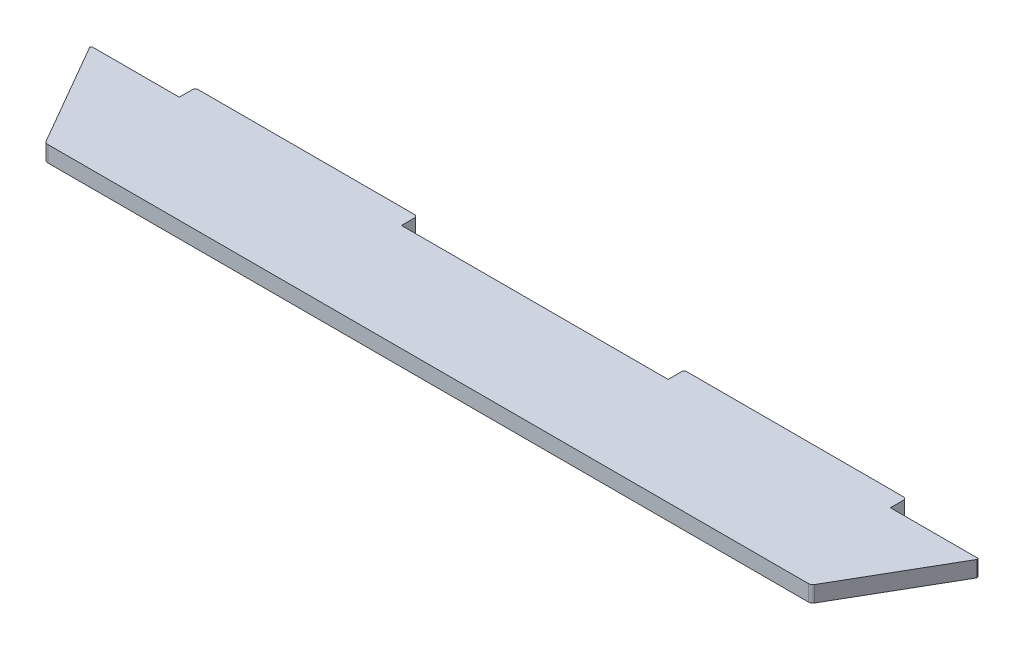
SolidWorks part; units mm, degrees
ref_plane "Alzado" through (0, 0, 0) normal (0, 0, 1) x (1, 0, 0)
ref_plane "Planta" through (0, 0, 0) normal (0, 1, 0) x (1, 0, 0)
ref_plane "Vista lateral" through (0, 0, 0) normal (1, 0, 0) x (0, 0, -1)
sketch "Croquis1" plane through (0, 0, 0) normal (0, 1, 0) x (1, 0, 0)
  line L0 (0, 0) -> (0, 433.0127) construction
  line L1 (250, 433.0127) -> (-250, 433.0127)
  line L2 (-250, 433.0127) -> (-500, 0)
  line L3 (-500, 0) -> (-250, -433.0127)
  line L4 (-250, -433.0127) -> (250, -433.0127)
  line L5 (250, -433.0127) -> (500, 0)
  line L6 (500, 0) -> (250, 433.0127)
  circle A0 centre (0, 0) radius 433.0127 construction
  dimension "D1" = 1000
extrude "Saliente-Extruir1" add sketch "Croquis1" along normal blind 18
sketch "Croquis2" plane through (0, 18, 0) normal (0, 1, 0) x (1, 0, 0)
  line L0 (500, 0) -> (250, 433.0127) construction
  line L1 (-500, 0) -> (500, 0)
  line L2 (-500, 0) -> (-500, 433.0127)
  line L3 (-500, 433.0127) -> (500, 433.0127)
  line L4 (500, 0) -> (500, 433.0127)
  line L6 (250, 433.0127) -> (-250, 433.0127) construction
extrude "Cortar-Extruir1" cut sketch "Croquis2" against normal through all
sketch "Croquis3" plane through (0, 18, 0) normal (0, 1, 0) x (1, 0, 0)
  line L0 (-500, 0) -> (500, 0) construction
  line L1 (-400, 0) -> (-150, 0)
  line L2 (-400, 0) -> (-400, 18)
  line L3 (-400, 18) -> (-150, 18)
  line L4 (-150, 0) -> (-150, 18)
  line L5 (-150, 18) -> (150, 18) construction
  line L10 (150, 0) -> (400, 0)
  line L11 (150, 0) -> (150, 18)
  line L12 (150, 18) -> (400, 18)
  line L13 (400, 0) -> (400, 18)
  line L14 (0, 18) -> (0, 0) construction
  dimension "D1" = 18
  dimension "D2" = 300
  dimension "D3" = 250
  dimension "D4" = 250
extrude "Saliente-Extruir2" add sketch "Croquis3" against normal through all
sketch "Croquis4" plane through (0, 18, 0) normal (0, 1, 0) x (1, 0, 0)
  line L0 (-250, -433.0127) -> (250, -433.0127) construction
  line L1 (-500, -120) -> (500, -120)
  line L2 (-500, -120) -> (-500, -433.0127)
  line L3 (-500, -433.0127) -> (500, -433.0127)
  line L4 (500, -120) -> (500, -433.0127)
  line L5 (-150, 0) -> (150, 0) construction
  dimension "D1" = 120
extrude "Cortar-Extruir2" cut sketch "Croquis4" against normal through all
fillet "Redondeo1" radius 5 2 edges at (-430.718, 9, 120) (430.718, 9, 120)
chamfer "Chaflán1" distance 2 angle 45 6 edges at (-500, 9, 0) (500, 9, 0) (150, 9, -18) (400, 9, -18) (-150, 9, -18) (-400, 9, -18)
